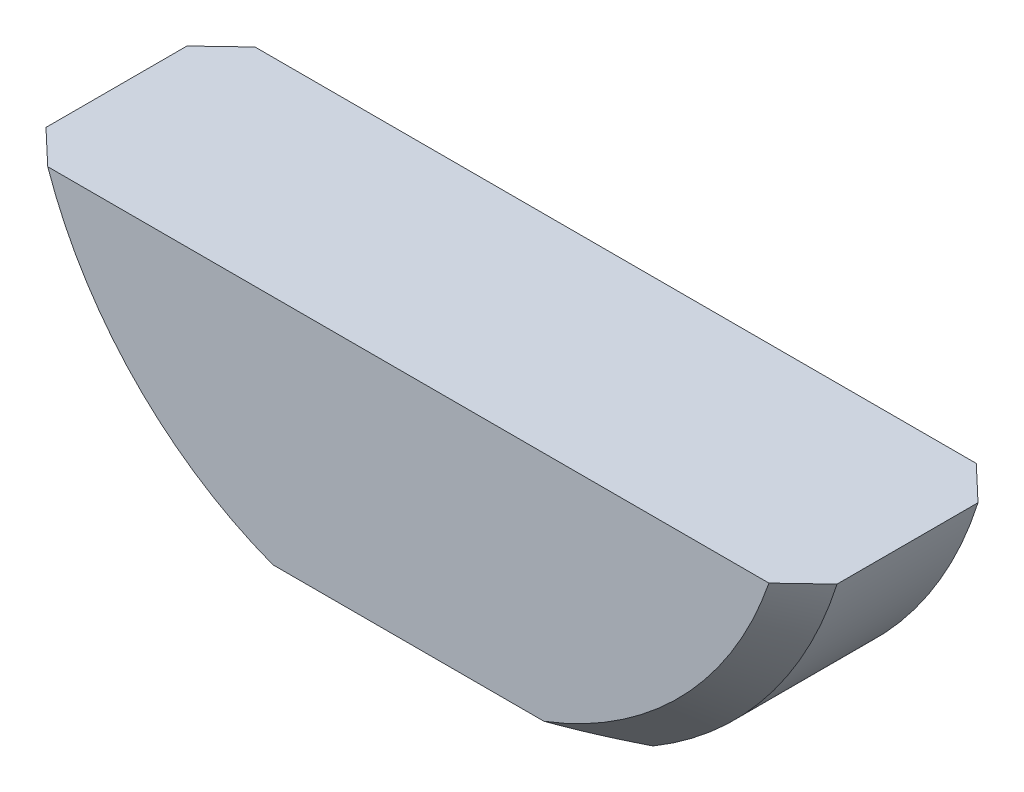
SolidWorks part; units mm, degrees
ref_plane "Front" through (0, 0, 0) normal (0, 0, 1) x (1, 0, 0)
ref_plane "Top" through (0, 0, 0) normal (0, 1, 0) x (1, 0, 0)
ref_plane "Right" through (0, 0, 0) normal (1, 0, 0) x (0, 0, -1)
other "Configuration Table"
sketch "Sketch1" plane through (0, 0, 0) normal (0, 0, 1) x (1, 0, 0)
  line L0 (-1.9079, 0) -> (1.9079, 0)
  arc A0 (-1.9079, 0) -> (1.9079, 0) centre (0, 0.6) ccw
extrude "Extrude1" add sketch "Sketch1" along normal blind 1
sketch "Sketch2" plane through (0, 0, 0) normal (0, 0, 1) x (1, 0, 0)
  line L0 (-1.9079, -1.12) -> (1.9079, -1.12)
  line L1 (1.9079, 0) -> (-1.9079, 0) construction
extrude "Cut-Extrude1" cut sketch "Sketch2" against normal through all and the other way through all flip side to cut
chamfer "Chamfer1" distance 0.16 angle 45 4 edges at (1.5677, -0.6419, 0) (-1.5677, -0.6419, 0) (1.5677, -0.6419, 1) (-1.5677, -0.6419, 1)
equation "\"h2@Sketch2\" = 0.8 * \"h1@Sketch1\""
